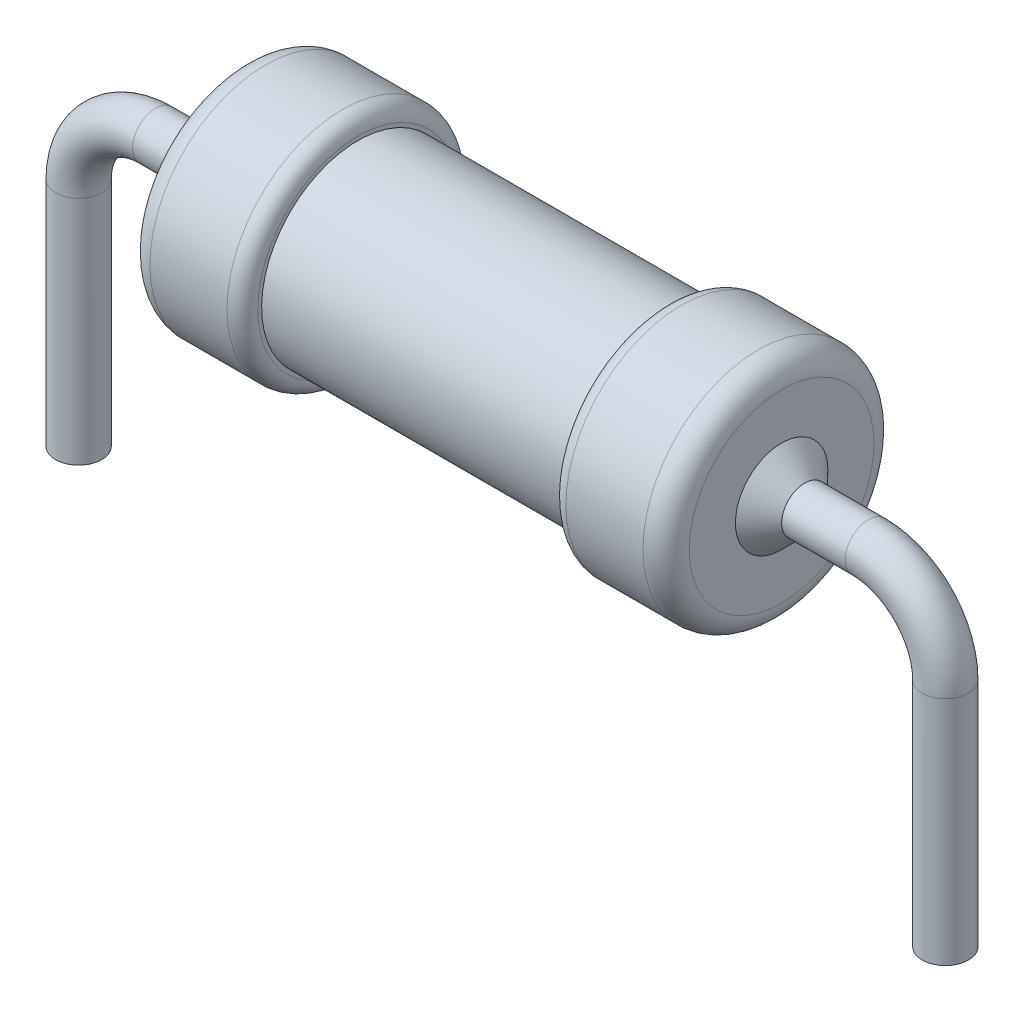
SolidWorks part; units mm, degrees
ref_plane "Front" through (0, 0, 0) normal (0, 0, 1) x (1, 0, 0)
ref_plane "Top" through (0, 0, 0) normal (0, 1, 0) x (1, 0, 0)
ref_plane "Right" through (0, 0, 0) normal (1, 0, 0) x (0, 0, -1)
sketch "Эскиз1" plane through (0, 0, 0) normal (0, 0, 1) x (1, 0, 0)
  line L0 (-3.8, 1.5) -> (-3.8, 1.8)
  line L2 (-3.5, 2.1) -> (-3.5, 2.7)
  line L3 (-3.2, 3) -> (-2.2, 3)
  line L4 (-2, 2.8) -> (-2, 2.75)
  line L5 (-2, 2.75) -> (2, 2.75)
  line L6 (-3.8, 1.5) -> (0, 1.5) construction
  line L7 (0, 1.5) -> (0, 2.75) construction
  line L8 (2, 2.8) -> (2, 2.75)
  line L9 (3.2, 3) -> (2.2, 3)
  line L10 (3.5, 2.1) -> (3.5, 2.7)
  line L12 (3.8, 1.5) -> (3.8, 1.8)
  line L13 (-3.8, 1.5) -> (3.8, 1.5)
  line L14 (-3.8, 1.8) -> (-3.5, 2.1)
  line L15 (0, 0) -> (0, 1.5) construction
  line L16 (-3.2, 0) -> (-2.2, 0) construction
  line L17 (3.8, 1.8) -> (3.5, 2.1)
  arc A0 (-3.5, 2.7) -> (-3.2, 3) centre (-3.2, 2.7) cw
  arc A1 (3.5, 2.7) -> (3.2, 3) centre (3.2, 2.7) ccw
  arc A2 (-2.2, 3) -> (-2, 2.8) centre (-2.2, 2.8) cw
  arc A3 (2, 2.8) -> (2.2, 3) centre (2.2, 2.8) cw
  point P23 (-2, 3)
  point P26 (2, 3)
  dimension "R" = 0.3
  dimension "D1" = 0.2
  dimension "D2" = 45
  dimension "D3" = 0.3
  dimension "Dv" = 0.6
  dimension "L" = 7
  dimension "D" = 3
  dimension "Do" = 2.5
  dimension "Lk" = 1.5
revolve "Повернуть1" add sketch "Эскиз1" angle 360 about L6
sketch "Эскиз2" plane through (0, 0, 0) normal (0, 0, 1) x (1, 0, 0)
  line L0 (-3.8, 1.5) -> (-4.625, 1.5)
  line L1 (-5.625, 0.5) -> (-5.625, -2.5)
  line L3 (0, 0.25) -> (0, 2.75) construction
  line L4 (-2, 0.25) -> (2, 0.25) construction
  line L5 (2, 2.75) -> (-2, 2.75) construction
  arc A0 (-4.625, 1.5) -> (-5.625, 0.5) centre (-4.625, 0.5) ccw
  dimension "D1" = 1
  dimension "D2" = 2.5
  dimension "D3" = 11.25
sketch "Эскиз3" plane through (-3.8, 0, 0) normal (-1, 0, 0) x (0, 0, 1)
  circle A1 centre (0, 1.5) radius 0.3
  circle A2 centre (0, 1.5) radius 0.3 construction
sketch "Эскиз4" plane through (0, 0, 0) normal (0, 0, 1) x (1, 0, 0)
  line L0 (3.8, 1.5) -> (4.625, 1.5)
  line L2 (5.625, 0.5) -> (5.625, -2.5)
  line L6 (-3.8, 1.5) -> (-4.625, 1.5) construction
  line L9 (-5.625, 0.5) -> (-5.625, -2.5) construction
  arc A0 (4.625, 1.5) -> (5.625, 0.5) centre (4.625, 0.5) cw
  arc A1 (-4.625, 1.5) -> (-5.625, 0.5) centre (-4.625, 0.5) ccw construction
sketch "Эскиз5" plane through (3.8, 0, 0) normal (1, 0, 0) x (0, 0, -1)
  circle A1 centre (0, 1.5) radius 0.3
  circle A2 centre (0, 1.5) radius 0.3 construction
sweep "По траектории1" add profiles "Эскиз3" path "Эскиз2"
sweep "По траектории2" add profiles "Эскиз5" path "Эскиз4" parameters "D3"=0.3, "D5"=0.3
